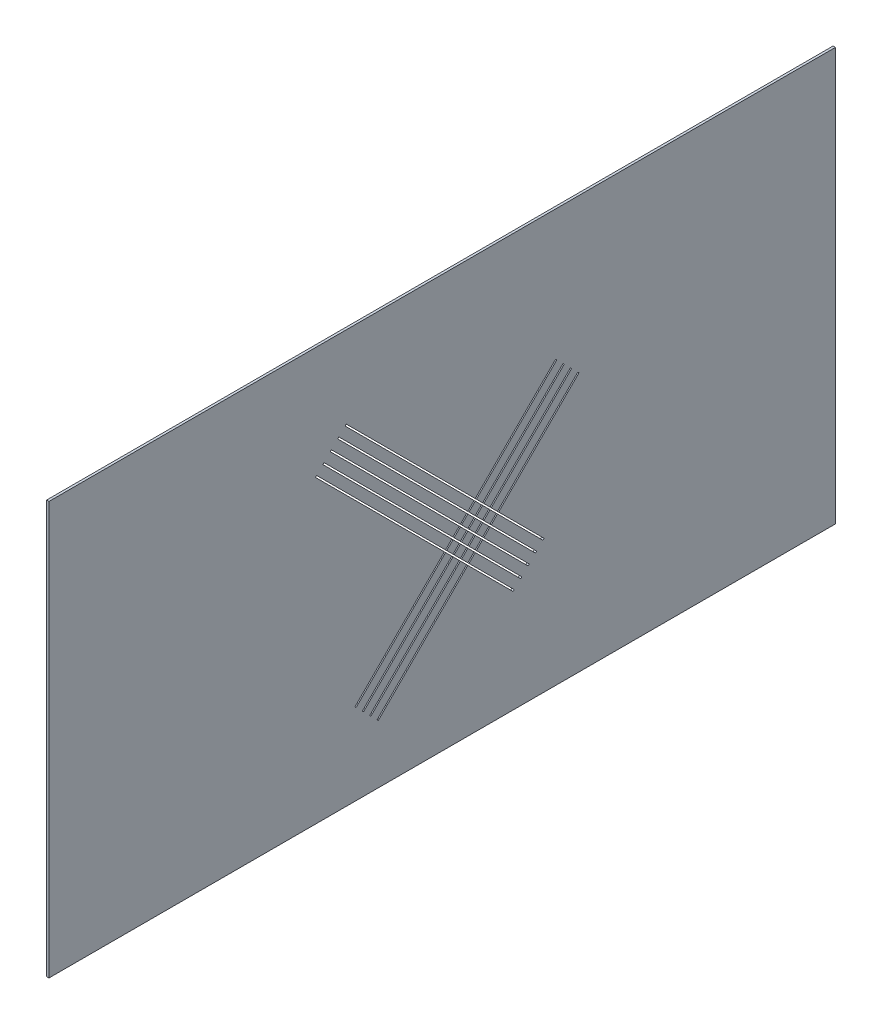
SolidWorks part; units mm, degrees
ref_plane "Front" through (0, 0, 0) normal (0, 0, 1) x (1, 0, 0)
ref_plane "Top" through (0, 0, 0) normal (0, 1, 0) x (1, 0, 0)
ref_plane "Right" through (0, 0, 0) normal (1, 0, 0) x (0, 0, -1)
sketch "Sketch1" plane through (0, 0, 0) normal (1, 0, 0) x (0, 0, -1)
  line L1 (0, 0) -> (1009.65, 0)
  line L2 (0, 0) -> (0, 529.844)
  line L3 (0, 529.844) -> (1009.65, 529.844)
  line L4 (1009.65, 0) -> (1009.65, 529.844)
  line L102 (380.1888, 423.5936) -> (545.7948, 257.9876)
  line L116 (537.7126, 249.9054) -> (372.1066, 415.5114)
  line L120 (548.6685, 257.9876) -> (651.8796, 361.1987)
  line L121 (659.9618, 353.1164) -> (556.7508, 249.9054)
  line L122 (661.3987, 351.6796) -> (558.1876, 248.4685)
  line L124 (650.4428, 362.6355) -> (547.2317, 259.4245)
  line L125 (381.6257, 425.0305) -> (547.2317, 259.4245)
  line L126 (370.6697, 414.0746) -> (536.2758, 248.4685)
  line L127 (548.6685, 238.9495) -> (556.7508, 247.0317)
  line L128 (547.2317, 240.3863) -> (555.3139, 248.4685)
  line L131 (558.1876, 248.4685) -> (566.2698, 240.3863)
  line L132 (556.7508, 247.0317) -> (564.833, 238.9495)
  line L133 (548.6685, 238.9495) -> (556.7508, 230.8672)
  line L134 (547.2317, 237.5126) -> (555.3139, 229.4304)
  line L135 (537.7126, 230.8672) -> (545.7948, 238.9495)
  line L136 (547.2317, 256.5508) -> (555.3139, 248.4685)
  line L137 (539.1495, 248.4685) -> (547.2317, 256.5508)
  line L138 (548.6685, 257.9876) -> (556.7508, 249.9054)
  line L139 (537.7126, 249.9054) -> (545.7948, 257.9876)
  line L140 (566.2698, 237.5126) -> (574.3521, 229.4304)
  line L141 (539.1495, 248.4685) -> (547.2317, 240.3863)
  line L142 (528.1935, 240.3863) -> (536.2758, 248.4685)
  line L143 (537.7126, 247.0317) -> (545.7948, 238.9495)
  line L144 (529.6304, 238.9495) -> (537.7126, 247.0317)
  line L145 (558.1876, 229.4304) -> (566.2698, 221.3482)
  line L146 (392.7933, 104.9861) -> (394.2301, 103.5492)
  line L147 (510.5863, 219.9054) -> (518.6745, 227.9936)
  line L148 (539.1495, 229.4304) -> (547.2317, 237.5126)
  line L149 (520.1113, 229.4304) -> (528.1935, 237.5126)
  line L150 (402.3124, 95.467) -> (517.2376, 210.3923)
  line L151 (370.6697, 414.0746) -> (372.1066, 415.5114)
  line L152 (361.1507, 404.5555) -> (526.7567, 238.9495)
  line L153 (547.2317, 221.3482) -> (555.3139, 229.4304)
  line L154 (518.6745, 227.9936) -> (526.7567, 219.9113)
  line L155 (528.1935, 221.3482) -> (536.2758, 229.4304)
  line L156 (520.1113, 210.3923) -> (528.1935, 202.31)
  line L157 (669.4809, 343.5974) -> (566.2698, 240.3863)
  line L158 (670.9177, 342.1605) -> (567.7067, 238.9495)
  line L159 (558.1876, 229.4304) -> (566.2698, 237.5126)
  line L160 (556.7508, 230.8672) -> (564.833, 238.9495)
  line L161 (548.6685, 219.9113) -> (556.7508, 227.9936)
  line L162 (403.7492, 94.0301) -> (518.6745, 208.9554)
  line L163 (679, 334.0783) -> (575.7889, 230.8672)
  line L164 (680.4368, 332.6415) -> (577.2257, 229.4304)
  line L165 (558.1876, 210.3923) -> (566.2698, 218.4745)
  line L166 (556.7508, 211.8291) -> (564.833, 219.9113)
  line L167 (575.7889, 227.9936) -> (567.7067, 219.9113)
  line L168 (566.2698, 221.3482) -> (574.3521, 229.4304)
  line L169 (528.1935, 237.5126) -> (536.2758, 229.4304)
  line L170 (353.0684, 396.4733) -> (518.6745, 230.8672)
  line L171 (362.5875, 405.9923) -> (528.1935, 240.3863)
  line L172 (351.6316, 395.0364) -> (517.2376, 229.4304)
  line L173 (539.1495, 229.4304) -> (547.2317, 221.3482)
  line L174 (537.7126, 227.9936) -> (545.7948, 219.9113)
  line L175 (529.6304, 238.9495) -> (537.7126, 230.8672)
  line L176 (520.1113, 210.3923) -> (528.1935, 218.4745)
  line L177 (343.5494, 386.9542) -> (509.1554, 221.3482)
  line L178 (392.7933, 104.9861) -> (507.7186, 219.9113)
  line L179 (529.6304, 219.9113) -> (537.7126, 227.9936)
  line L180 (528.1935, 218.4745) -> (536.2758, 210.3923)
  line L181 (342.1125, 385.5174) -> (507.7186, 219.9113)
  line L182 (509.1554, 218.4745) -> (517.2376, 210.3923)
  line L183 (520.1113, 229.4304) -> (528.1935, 221.3482)
  line L184 (510.5863, 219.9054) -> (518.6685, 211.8232)
  line L185 (526.7567, 219.9113) -> (518.6685, 211.8232)
  line L186 (518.6745, 208.9554) -> (526.7567, 200.8732)
  line L187 (556.7508, 227.9936) -> (564.833, 219.9113)
  line L188 (509.1554, 221.3482) -> (517.2376, 229.4304)
  line L189 (518.6745, 230.8672) -> (526.7567, 238.9495)
  line L190 (567.7067, 238.9495) -> (575.7889, 230.8672)
  line L191 (577.2257, 229.4304) -> (635.5958, 171.0603)
  line L192 (575.7889, 227.9936) -> (634.159, 169.6235)
  line L193 (567.7067, 219.9113) -> (626.0768, 161.5412)
  line L194 (566.2698, 218.4745) -> (624.6399, 160.1044)
  line L195 (529.6304, 219.9113) -> (537.7126, 211.8291)
  line L196 (342.1125, 385.5174) -> (343.5494, 386.9542)
  line L197 (547.2317, 218.4745) -> (555.3139, 210.3923)
  line L198 (351.6316, 395.0364) -> (353.0684, 396.4733)
  line L199 (548.6685, 200.8732) -> (556.7508, 208.9554)
  line L200 (547.2317, 202.31) -> (555.3139, 210.3923)
  line L201 (615.1209, 150.5853) -> (616.5577, 152.0222)
  line L202 (537.7126, 208.9554) -> (545.7948, 200.8732)
  line L203 (605.6018, 141.0662) -> (607.0386, 142.5031)
  line L204 (539.1495, 191.3541) -> (547.2317, 199.4363)
  line L205 (529.6304, 200.8732) -> (537.7126, 192.791)
  line L206 (547.2317, 199.4363) -> (605.6018, 141.0662)
  line L207 (529.6304, 200.8732) -> (537.7126, 208.9554)
  line L208 (539.1495, 210.3923) -> (547.2317, 202.31)
  line L209 (361.1507, 404.5555) -> (362.5875, 405.9923)
  line L210 (422.7874, 74.992) -> (537.7126, 189.9173)
  line L211 (595.8187, 131.8112) -> (597.2555, 133.248)
  line L212 (421.3505, 76.4288) -> (536.2758, 191.3541)
  line L213 (537.7126, 189.9173) -> (595.8187, 131.8112)
  line L214 (545.7948, 200.8732) -> (537.7126, 192.791)
  line L215 (411.8314, 85.9479) -> (526.7567, 200.8732)
  line L216 (528.1935, 199.4363) -> (536.2758, 191.3541)
  line L217 (413.2683, 84.5111) -> (528.1935, 199.4363)
  line L218 (528.1935, 202.31) -> (536.2758, 210.3923)
  line L219 (539.1495, 210.3923) -> (547.2317, 218.4745)
  line L220 (537.7126, 211.8291) -> (545.7948, 219.9113)
  line L221 (548.6685, 219.9113) -> (556.7508, 211.8291)
  line L222 (624.6399, 160.1044) -> (626.0768, 161.5412)
  line L223 (650.4428, 362.6355) -> (651.8796, 361.1987)
  line L224 (659.9618, 353.1164) -> (661.3987, 351.6796)
  line L225 (669.4809, 343.5974) -> (670.9177, 342.1605)
  line L226 (539.1495, 191.3541) -> (597.2555, 133.248)
  line L227 (548.6685, 200.8732) -> (607.0386, 142.5031)
  line L228 (394.2301, 103.5492) -> (509.1554, 218.4745)
  line L229 (402.3124, 95.467) -> (403.7492, 94.0301)
  line L230 (411.8314, 85.9479) -> (413.2683, 84.5111)
  line L231 (558.1876, 210.3923) -> (616.5577, 152.0222)
  line L232 (556.7508, 208.9554) -> (615.1209, 150.5853)
  line L233 (421.3505, 76.4288) -> (422.7874, 74.992)
  line L234 (380.1888, 423.5936) -> (381.6257, 425.0305)
  line L235 (679, 334.0783) -> (680.4368, 332.6415)
  line L236 (635.5958, 171.0603) -> (634.159, 169.6235)
  dimension "D1" = 1009.65
  dimension "D2" = 529.844
extrude "Extrude3" add sketch "Sketch1" along normal blind 3.048
